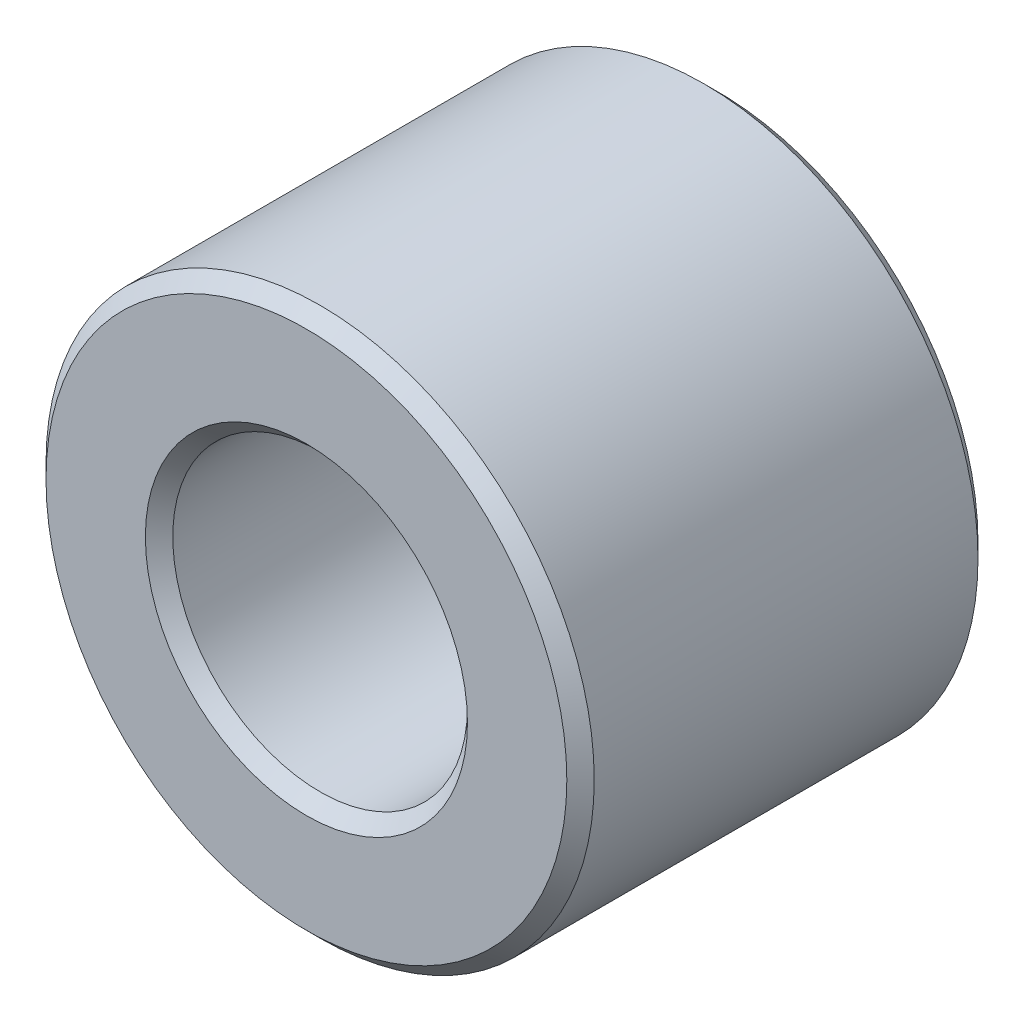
SolidWorks part; units mm, degrees
ref_plane "Front Plane" through (0, 0, 0) normal (0, 0, 1) x (1, 0, 0)
ref_plane "Top Plane" through (0, 0, 0) normal (0, 1, 0) x (1, 0, 0)
ref_plane "Right Plane" through (0, 0, 0) normal (1, 0, 0) x (0, 0, -1)
sketch "Sketch1" plane through (0, 0, 0) normal (0, 0, 1) x (1, 0, 0)
  circle A0 centre (0, 0) radius 4
  circle A1 centre (0, 0) radius 2.15
  dimension "D1" = 8
  dimension "D2" = 4.3
extrude "Boss-Extrude2" add sketch "Sketch1" along normal mid plane 6
chamfer "Chamfer3" distance 0.2 angle 45 4 edges at (4, 0, 3) (4, 0, -3) (2.15, 0, -3) (2.15, 0, 3)
